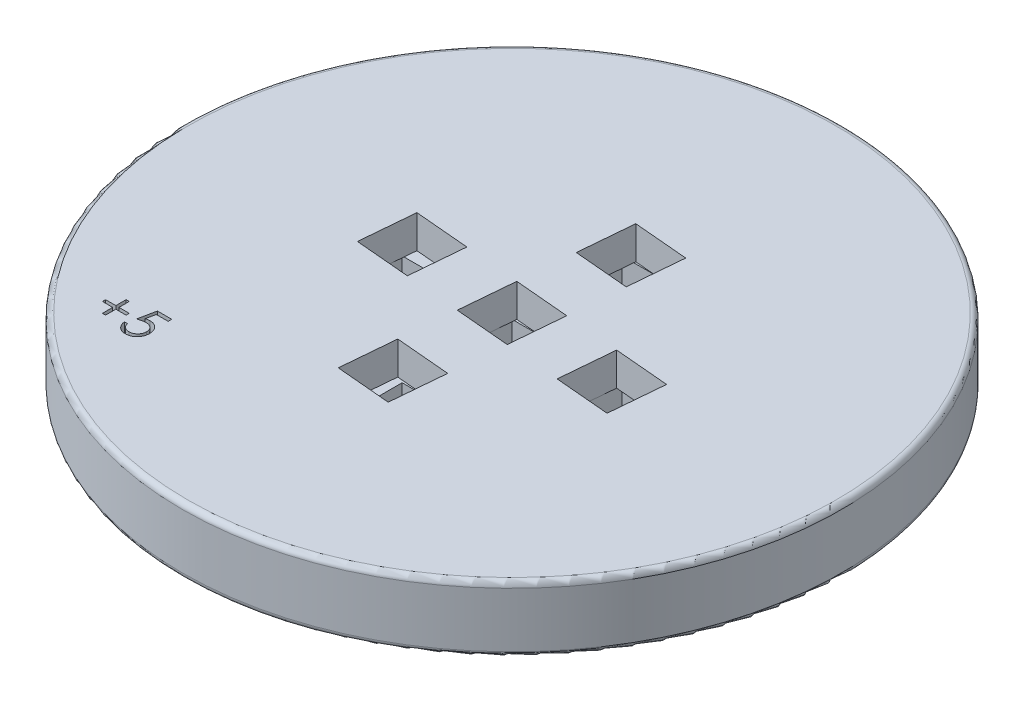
SolidWorks part; units mm, degrees
ref_plane "Front Plane" through (0, 0, 0) normal (0, 0, 1) x (1, 0, 0)
ref_plane "Top Plane" through (0, 0, 0) normal (0, 1, 0) x (1, 0, 0)
ref_plane "Right Plane" through (0, 0, 0) normal (1, 0, 0) x (0, 0, -1)
sketch "Sketch1" plane through (0, 0, 0) normal (0, 1, 0) x (1, 0, 0)
  circle A0 centre (0, 0) radius 30
extrude "Boss-Extrude1" add sketch "Sketch1" along normal blind 6
sketch "Sketch2" plane through (0, 6, 0) normal (0, 1, 0) x (1, 0, 0)
  line L0 (0, 0) -> (0, -10) construction
  line L1 (0, 0) -> (10, 0) construction
  line L2 (0, 0) -> (-10, 0) construction
  line L3 (0, 0) -> (0, 10) construction
  line L5 (-2.5, -7.5) -> (2.5, -7.5)
  line L6 (-2.5, -7.5) -> (-2.5, -12.5)
  line L7 (-2.5, -12.5) -> (2.5, -12.5)
  line L8 (2.5, -7.5) -> (2.5, -12.5)
  line L9 (-2.5, -7.5) -> (2.5, -12.5) construction
  line L10 (-2.5, -12.5) -> (2.5, -7.5) construction
  line L11 (-7.5, -2.5) -> (-12.5, -2.5)
  line L12 (-7.5, -2.5) -> (-7.5, 2.5)
  line L13 (-7.5, 2.5) -> (-12.5, 2.5)
  line L14 (-12.5, -2.5) -> (-12.5, 2.5)
  line L15 (-7.5, -2.5) -> (-12.5, 2.5) construction
  line L16 (-7.5, 2.5) -> (-12.5, -2.5) construction
  line L17 (2.5, -2.5) -> (-2.5, -2.5)
  line L18 (2.5, -2.5) -> (2.5, 2.5)
  line L19 (2.5, 2.5) -> (-2.5, 2.5)
  line L20 (-2.5, -2.5) -> (-2.5, 2.5)
  line L21 (2.5, -2.5) -> (-2.5, 2.5) construction
  line L22 (2.5, 2.5) -> (-2.5, -2.5) construction
  line L23 (-2.5, 12.5) -> (2.5, 12.5)
  line L24 (-2.5, 12.5) -> (-2.5, 7.5)
  line L25 (-2.5, 7.5) -> (2.5, 7.5)
  line L26 (2.5, 12.5) -> (2.5, 7.5)
  line L27 (-2.5, 12.5) -> (2.5, 7.5) construction
  line L28 (-2.5, 7.5) -> (2.5, 12.5) construction
  line L29 (12.5, -2.5) -> (7.5, -2.5)
  line L30 (12.5, -2.5) -> (12.5, 2.5)
  line L31 (12.5, 2.5) -> (7.5, 2.5)
  line L32 (7.5, -2.5) -> (7.5, 2.5)
  line L33 (12.5, -2.5) -> (7.5, 2.5) construction
  line L34 (12.5, 2.5) -> (7.5, -2.5) construction
  dimension "D1" = 5
  dimension "D2" = 10
  dimension "D3" = 5
  dimension "D4" = 5
  dimension "D5" = 5
  dimension "D6" = 5
  dimension "D7" = 5
  dimension "D8" = 5
sketch "Sketch3" plane through (0, 6, 0) normal (0, 1, 0) x (1, 0, 0)
sketch "Sketch4" plane through (0, 0, 0) normal (0, -1, 0) x (-1, 0, 0)
  line L0 (0, 0) -> (-10, 0) construction
  line L1 (0, 0) -> (0, -10) construction
  line L2 (0, 0) -> (0, 10) construction
  line L3 (0, 0) -> (10, 0) construction
  line L5 (-2.5, 2.5) -> (2.5, 2.5)
  line L6 (-2.5, 2.5) -> (-2.5, -2.5)
  line L7 (-2.5, -2.5) -> (2.5, -2.5)
  line L8 (2.5, 2.5) -> (2.5, -2.5)
  line L9 (-2.5, 2.5) -> (2.5, -2.5) construction
  line L10 (-2.5, -2.5) -> (2.5, 2.5) construction
  line L11 (-2.5, -7.5) -> (2.5, -7.5)
  line L12 (-2.5, -7.5) -> (-2.5, -12.5)
  line L13 (-2.5, -12.5) -> (2.5, -12.5)
  line L14 (2.5, -7.5) -> (2.5, -12.5)
  line L15 (-2.5, -7.5) -> (2.5, -12.5) construction
  line L16 (-2.5, -12.5) -> (2.5, -7.5) construction
  line L17 (7.5, 2.5) -> (12.5, 2.5)
  line L18 (7.5, 2.5) -> (7.5, -2.5)
  line L19 (7.5, -2.5) -> (12.5, -2.5)
  line L20 (12.5, 2.5) -> (12.5, -2.5)
  line L21 (7.5, 2.5) -> (12.5, -2.5) construction
  line L22 (7.5, -2.5) -> (12.5, 2.5) construction
  line L23 (-12.5, 2.5) -> (-7.5, 2.5)
  line L24 (-12.5, 2.5) -> (-12.5, -2.5)
  line L25 (-12.5, -2.5) -> (-7.5, -2.5)
  line L26 (-7.5, 2.5) -> (-7.5, -2.5)
  line L27 (-12.5, 2.5) -> (-7.5, -2.5) construction
  line L28 (-12.5, -2.5) -> (-7.5, 2.5) construction
  line L29 (2.5, 7.5) -> (-2.5, 7.5)
  line L30 (2.5, 7.5) -> (2.5, 12.5)
  line L31 (2.5, 12.5) -> (-2.5, 12.5)
  line L32 (-2.5, 7.5) -> (-2.5, 12.5)
  line L33 (2.5, 7.5) -> (-2.5, 12.5) construction
  line L34 (2.5, 12.5) -> (-2.5, 7.5) construction
  dimension "D1" = 5
  dimension "D2" = 5
  dimension "D3" = 5
  dimension "D4" = 5
  dimension "D5" = 5
  dimension "D6" = 5
extrude "Cut-Extrude2" cut sketch "Sketch4" against normal blind 3
fillet "Fillet2" radius 0.5 21 edges at (0, 0, 30) (2.5, 0, 0) (0, 0, 2.5) (-2.5, 0, 0) (0, 0, -2.5) (2.5, 0, 10) (0, 0, 12.5) (-2.5, 0, 10) (0, 0, 7.5) (-7.5, 0, 0) (-10, 0, 2.5) (-12.5, 0, 0) (-10, 0, -2.5) (12.5, 0, 0) (10, 0, 2.5) (7.5, 0, 0) (10, 0, -2.5) (-2.5, 0, -10) (0, 0, -12.5) (2.5, 0, -10) (0, 0, -7.5)
fillet "Fillet3" radius 0.5 1 edges at (0, 6, 30)
sketch "Sketch5" plane through (0, 6, 0) normal (0, 1, 0) x (1, 0, 0)
sketch "Sketch6" plane through (0, 6, 0) normal (0, 1, 0) x (1, 0, 0)
  line L0 (0, -30) -> (0, 30) construction
  line L1 (0, 0) -> (2.6147, 29.8858) construction
  line L2 (-2.7084, -2.2726) -> (2.2726, -2.7084)
  line L3 (-2.7084, -2.2726) -> (-2.2726, 2.7084)
  line L4 (2.2726, -2.7084) -> (2.7084, 2.2726)
  line L5 (-2.2726, 2.7084) -> (2.7084, 2.2726)
  line L6 (-2.7084, -2.2726) -> (2.7084, 2.2726) construction
  line L7 (2.2726, -2.7084) -> (-2.2726, 2.7084) construction
  line L8 (-1.8368, 7.6893) -> (3.1442, 7.2536)
  line L9 (-1.8368, 7.6893) -> (-1.401, 12.6703)
  line L10 (3.1442, 7.2536) -> (3.5799, 12.2345)
  line L11 (-1.401, 12.6703) -> (3.5799, 12.2345)
  line L12 (-1.8368, 7.6893) -> (3.5799, 12.2345) construction
  line L13 (3.1442, 7.2536) -> (-1.401, 12.6703) construction
  line L14 (0, 0) -> (-2.5711, -29.3877) construction
  line L15 (1.401, -12.6703) -> (-3.5799, -12.2345)
  line L16 (1.401, -12.6703) -> (1.8368, -7.6893)
  line L17 (-3.5799, -12.2345) -> (-3.1442, -7.2536)
  line L18 (1.8368, -7.6893) -> (-3.1442, -7.2536)
  line L19 (1.401, -12.6703) -> (-3.1442, -7.2536) construction
  line L20 (-3.5799, -12.2345) -> (1.8368, -7.6893) construction
  line L21 (0, 0) -> (-29.3877, 2.5711) construction
  line L22 (0, 0) -> (29.3877, -2.5711) construction
  line L23 (12.2345, -3.5799) -> (7.2536, -3.1442)
  line L24 (12.2345, -3.5799) -> (12.6703, 1.401)
  line L25 (7.2536, -3.1442) -> (7.6893, 1.8368)
  line L26 (12.6703, 1.401) -> (7.6893, 1.8368)
  line L27 (12.2345, -3.5799) -> (7.6893, 1.8368) construction
  line L28 (7.2536, -3.1442) -> (12.6703, 1.401) construction
  line L29 (-12.6703, -1.401) -> (-7.6893, -1.8368)
  line L30 (-12.6703, -1.401) -> (-12.2345, 3.5799)
  line L31 (-7.6893, -1.8368) -> (-7.2536, 3.1442)
  line L32 (-12.2345, 3.5799) -> (-7.2536, 3.1442)
  line L33 (-12.6703, -1.401) -> (-7.2536, 3.1442) construction
  line L34 (-7.6893, -1.8368) -> (-12.2345, 3.5799) construction
  line L35 (-19.7925, -19.1609) -> (-15.799, -19.1609) construction
  circle A0 centre (0, 0) radius 30 construction
  circle A1 centre (0, 0) radius 29.5 construction
  text T0 "+5"
  point P8 (0.8716, 9.9619)
  point P21 (-0.8716, -9.9619)
  point P23 (9.9619, -0.8716)
  point P28 (-9.9619, 0.8716)
  dimension "D1" = 5
  dimension "D2" = 5
  dimension "D3" = 5
  dimension "D4" = 10
  dimension "D5" = 5
  dimension "D6" = 5
  dimension "D7" = 5
  dimension "D8" = 5
  dimension "D9" = 5
  dimension "D10" = 90
  dimension "D11" = 90
  dimension "D12" = 10
  dimension "D13" = 5
  dimension "D14" = 5
  dimension "D15" = 180
  dimension "D16" = 5
  dimension "D17" = 5
  dimension "D18" = 180
  dimension "D19" = 10
  dimension "D20" = 10
extrude "Cut-Extrude3" cut sketch "Sketch6" against normal blind 3
